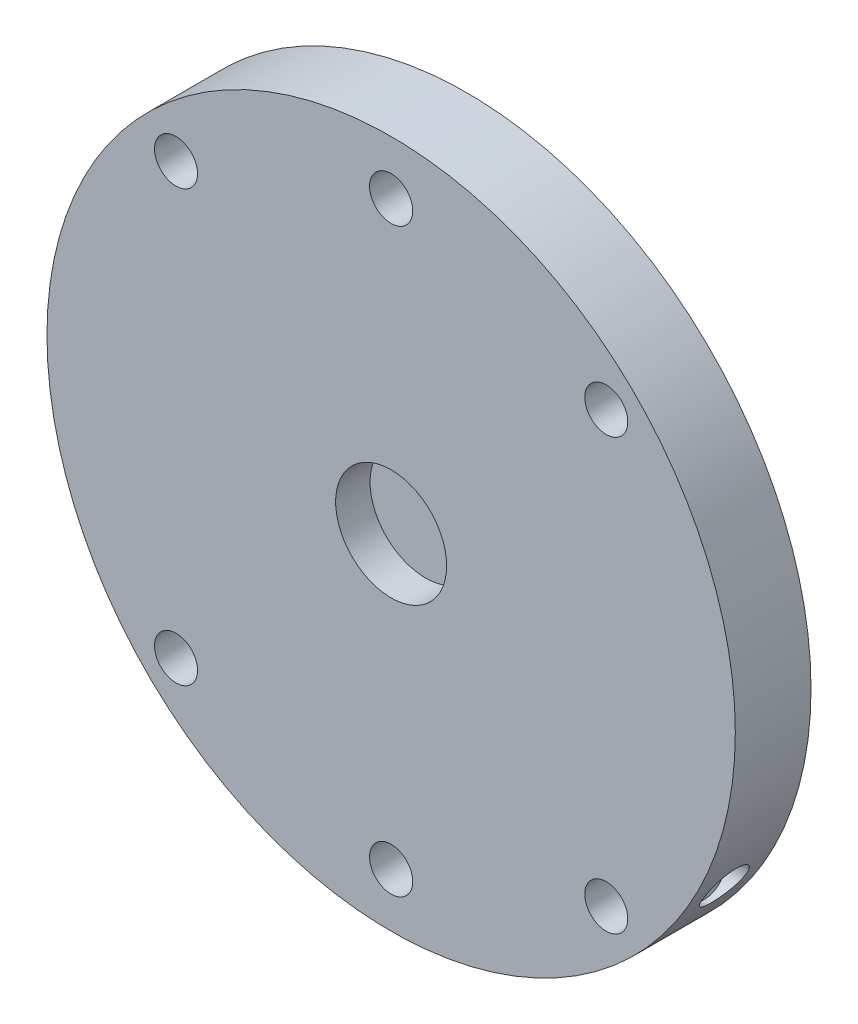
SolidWorks part; units mm, degrees
ref_plane "Front" through (0, 0, 0) normal (0, 0, 1) x (1, 0, 0)
ref_plane "Top" through (0, 0, 0) normal (0, 1, 0) x (1, 0, 0)
ref_plane "Right" through (0, 0, 0) normal (1, 0, 0) x (0, 0, -1)
imported_body "Imported1"
sketch "Sketch1" plane through (0, 0, 0) normal (0, 0, 1) x (1, 0, 0)
  circle A0 centre (0, -19.1819) radius 1.27
  dimension "D1" = 2.54
extrude "Boss-Extrude1" add sketch "Sketch1" against normal blind 10.16
